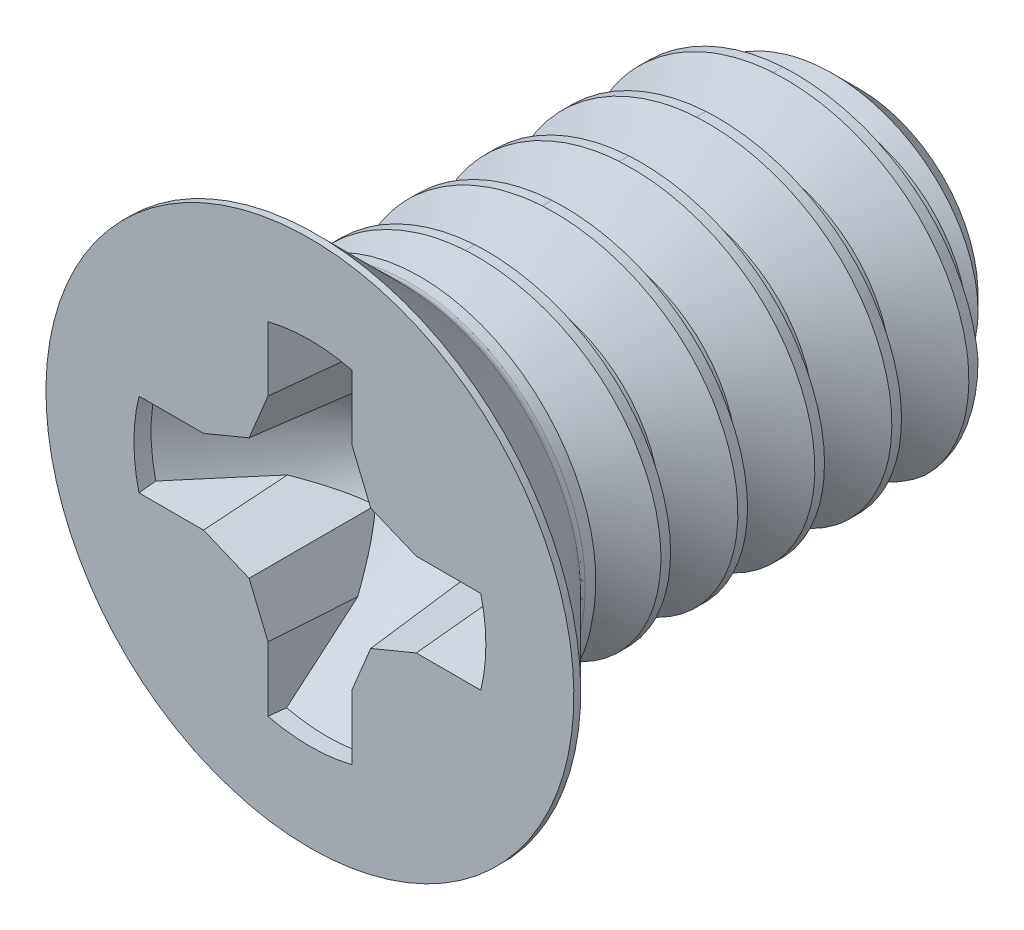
SolidWorks part; units mm, degrees
ref_plane "Front Plane" through (0, 0, 0) normal (0, 0, 1) x (1, 0, 0)
ref_plane "Top Plane" through (0, 0, 0) normal (0, 1, 0) x (1, 0, 0)
ref_plane "Right Plane" through (0, 0, 0) normal (1, 0, 0) x (0, 0, -1)
sketch "Sketch1" plane through (0, 0, 0) normal (1, 0, 0) x (0, 0, -1)
  line L0 (0, 0) -> (-0.5, 0) construction
  line L1 (-0.5, 1.2) -> (-0.5, -1.2) construction
  line L2 (-0.5, 1.2) -> (0, 0.7) construction
  line L3 (-0.5, -1.2) -> (0, -0.7) construction
  line L4 (0, 0.8) -> (0, -0.8) construction
  line L5 (0, 0) -> (2, 0) construction
  line L6 (0, 0.8) -> (0.35, 0.8) construction
  point P6 (1.475, -0.8)
  point P11 (0, 0)
  point P12 (0, 0.8)
  point P15 (0, 0)
  point P16 (-0.5, 0)
sketch "Sketch2" plane through (0, 0, 0) normal (0, 0, 1) x (1, 0, 0)
  line L0 (0.1905, 0.8) -> (-0.1905, 0.8) construction
  circle A0 centre (0, 0) radius 0.8 construction
  point P3 (0, 0.8)
  point P4 (0, -0.8)
  point P7 (0, 0.8)
  dimension "Drive Diameter" = 1.6
  dimension "Drive Width" = 0.381
sketch "Sketch3" plane through (0, 0, 0) normal (1, 0, 0) x (0, 0, -1)
  line L0 (-0.5, 0) -> (-0.5, 1.2)
  line L1 (-0.4688, 1.2) -> (-0.0688, 0.8)
  line L3 (0, 0.8) -> (0.35, 0.8) construction
  line L4 (-0.5, 0) -> (-0.0688, 0)
  line L5 (0, 0) -> (-0.5, 0) construction
  line L6 (-0.0688, 0) -> (-0.0688, 0.8)
  line L7 (-0.5, 1.2) -> (0, 0.7) construction
  line L8 (-0.5, 1.2) -> (-0.4688, 1.2)
revolve "Revolve1" add sketch "Sketch3" angle 360 about L4
sketch "Sketch5" plane through (0, 0, 0) normal (1, 0, 0) x (0, 0, -1)
  line L0 (2, 0) -> (-0.0688, 0)
  line L1 (0, 0) -> (2, 0) construction
  line L2 (-0.0688, 0) -> (-0.0688, 0.8)
  line L3 (-0.0688, 0.8) -> (1.7375, 0.8)
  line L4 (1.7375, 0.8) -> (2, 0.5375)
  line L5 (2, 0.5375) -> (2, 0)
  line L6 (1.7375, 0.8) -> (2, 0.8) construction
  line L7 (2, 0.8) -> (2, 0.5375) construction
  line L8 (0, 0.8) -> (0.35, 0.8) construction
  line L9 (-0.0688, -0.8) -> (-0.0688, 0.8) construction
revolve "Revolve2" add sketch "Sketch5" angle 360 about L0
sketch "Sketch4" plane through (0, 0, 0.5) normal (0, 0, 1) x (1, 0, 0)
  line L0 (0, 0) -> (0, 0.8)
  line L1 (0, 0) -> (0.8, 0)
  line L2 (0, 0) -> (0.4837, 0.4837) construction
  line L3 (0.1905, 0.777) -> (0.1905, 0.4837)
  line L4 (0.1905, 0.4837) -> (0.1905, 0.1905) construction
  line L5 (0.4837, 0.1905) -> (0.1905, 0.1905) construction
  line L6 (0.777, 0.1905) -> (0.4837, 0.1905)
  line L7 (0.1905, 0.4837) -> (0.2764, 0.2764)
  line L8 (0.2764, 0.2764) -> (0.4837, 0.1905)
  line L9 (0, 0.8) -> (0, 1.2312) construction
  line L10 (0, 1.2) -> (0, -1.2) construction
  arc A1 (0, 0.8) -> (0.1905, 0.777) centre (0, 0) cw
  arc A2 (0.8, 0) -> (0.777, 0.1905) centre (0, 0) ccw
  arc A3 (0.4837, 0.1905) -> (0.1905, 0.4837) centre (0.4837, 0.4837) cw construction
  circle A4 centre (0, 0) radius 1.2312 construction
  point P8 (0.2764, 0.2764)
extrude "Cut-Extrude1" cut sketch "Sketch4" against normal offset from surface (0.8777 mm away) 0.25 contours L1 A2 L6 L8 L7 L3 A1 L0
pattern_circular "CirPattern1" count 4 over 360 about axis through (0, 0, 0) along (0, 0, 1) of "Cut-Extrude1"
draft "Draft2" type of draft neutral plane draft angle 5 faces to draft 16 parameters "D1"=5
fillet "Fillet1" radius 0.05 1 edges at (0, 0.8, 0.0688)
ref_plane "Plane1" through (0, 0, 0) normal (0, 0, -1) x (-1, 0, 0)
split "Split1" trim tools "Plane1" bodies to split 107 105 resulting bodies 108 109
sketch "Sketch6" plane through (0, 0, -2) normal (0, 0, 1) x (1, 0, 0)
  circle A1 centre (0, 0) radius 0.8
  circle A2 centre (0, 0) radius 0.8
  dimension "D1" = 0
curve "Helix/Spiral1"
sketch "Sketch7" plane through (0, 0, 0) normal (1, 0, 0) x (0, 0, -1)
  line L0 (1.9781, 0.8379) -> (2.3281, 0.8379) construction
  line L1 (1.9781, 0.8379) -> (2.1531, 0.5348) construction
  line L2 (2.1531, 0.5348) -> (2.3281, 0.8379) construction
  line L3 (2.1313, 0.5727) -> (2.175, 0.5727) construction
  line L4 (2, 0.8) -> (2.3063, 0.8) construction
  line L5 (2.1531, 0.8) -> (2.1531, 0.8379) construction
  line L6 (2.1531, 0.5727) -> (2.1531, 0.5348) construction
  line L7 (2.1531, 0.8189) -> (1.9891, 0.8189) construction
  line L10 (2.175, 0.5727) -> (2.1313, 0.5727)
  line L11 (1.9891, 0.8189) -> (2.1313, 0.5727)
  line L12 (1.9891, 0.8189) -> (2.3172, 0.8189)
  line L13 (2.3172, 0.8189) -> (2.175, 0.5727)
  line L14 (2.1531, 0.8) -> (2.1531, -0.8) construction
  line L15 (2.1531, -0.8) -> (1.8031, -0.8) construction
  line L16 (1.8031, -0.8) -> (1.4531, -0.8) construction
  line L17 (1.4531, -0.8) -> (1.1031, -0.8) construction
  line L18 (1.1031, -0.8) -> (0.7531, -0.8) construction
  line L19 (0.7531, -0.8) -> (0.4031, -0.8) construction
  point P16 (2.1531, 0)
  point P23 (1.1031, -0.8)
  point P24 (1.4531, -0.8)
  point P25 (0.7531, -0.8)
  point P26 (0.4031, -0.8)
sweep "Cut-Sweep1" cut profiles "Sketch7" path "Helix/Spiral1"
combine bodies "Combine1" operation type add bodies to combine 109 110
equation "\"D1@Sketch5\"=\"Pitch@Sketch1\"*.75"
equation "\"D4@Helix/Spiral1\"=\"Pitch@Sketch1\""
equation "\"D3@Helix/Spiral1\"=\"Length@Sketch1\""
equation "\"D1@Sketch7\"=\"Pitch@Sketch1\""
equation "\"D2@Sketch7\"=\"Pitch@Sketch1\"/8"
equation "\"D1@Cut-Extrude1\"=\"Head Height@Sketch1\"*.5"
equation "\"D1@Sketch3\"=\"Head height@Sketch1\"*.0625"
equation "\"D1@Fillet1\"=\"Screw Size Decimal Equivalent@Sketch1\"*.03125"
equation "\"D1@Sketch1\"=\"Pitch@Sketch1\"*1.5"
